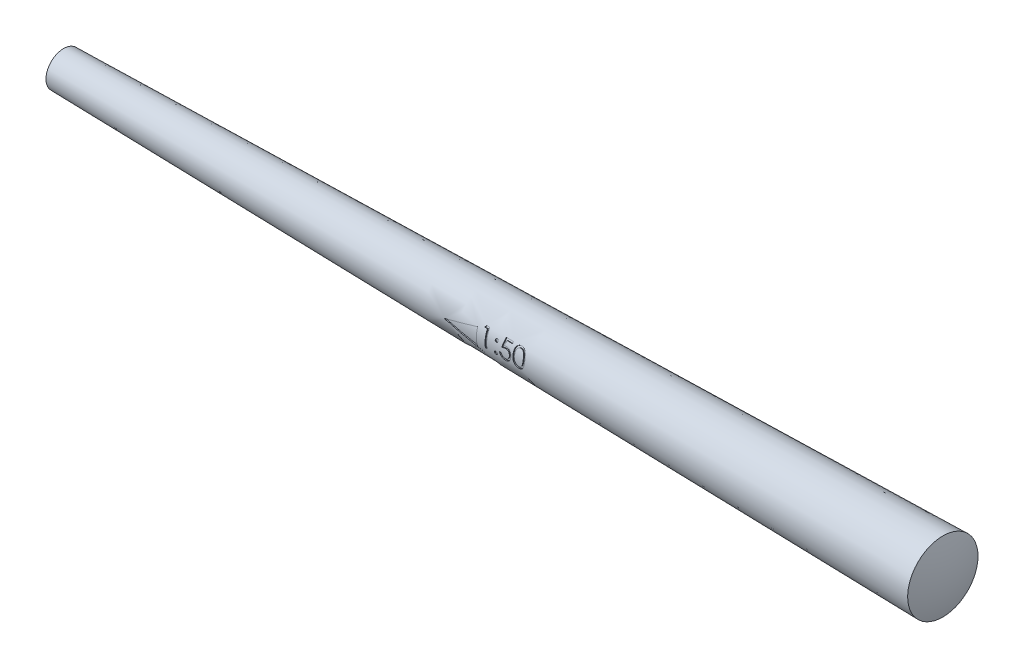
SolidWorks part; units mm, degrees
ref_plane "Front Plane" through (0, 0, 0) normal (0, 0, 1) x (1, 0, 0)
ref_plane "Top Plane" through (0, 0, 0) normal (0, 1, 0) x (1, 0, 0)
ref_plane "Right Plane" through (0, 0, 0) normal (1, 0, 0) x (0, 0, -1)
sketch "Sketch1" plane through (0, 0, 0) normal (1, 0, 0) x (0, 0, -1)
  circle A0 centre (0, 0) radius 1
  dimension "D1" = 2
extrude "Extrude1" add sketch "Sketch1" along normal mid plane 50
draft "Draft1" type of draft neutral plane draft angle 1.146 faces to draft 1 parameters "D1"=1.146
sketch "Sketch2" plane through (0, 0, 0) normal (0, 0, 1) x (1, 0, 0)
  line L0 (-25, 0) -> (-25, 1)
  line L1 (-25, 1) -> (-25, -1) construction
  line L2 (-25, 0) -> (-25.3, 0)
  line L3 (-25.3, 0) -> (-25.3, -1.5) construction
  line L4 (25, 0) -> (25, 2)
  line L5 (25, -2) -> (25, 2) construction
  line L6 (25, 0) -> (25.3, 0)
  line L7 (25.3, 0) -> (25.3, -1.5) construction
  line L8 (-25, -1) -> (25, -2) construction
  arc A0 (-25.3, 0) -> (-25, 1) centre (-23.4833, 0) cw
  arc A1 (25.3, 0) -> (25, 2) centre (18.4831, 0) ccw
  point P14 (0, -1.5)
revolve "Revolve1" add sketch "Sketch2" angle 360 about L2
sketch "Sketch5" plane through (0, 0, 0) normal (0, 0, 1) x (1, 0, 0)
  line L0 (0, 1.5) -> (0, -1.5) construction
  line L1 (25, 2) -> (-25, 1) construction
  line L2 (-25, -1) -> (25, -2) construction
ref_plane "Plane2" through (0, 0, 0) normal (-0.02, 0, 0.9998) x (0.9998, 0, 0.02)
sketch "Sketch6" plane through (0, 0, 0) normal (-0.02, 0, 0.9998) x (0.9998, 0, 0.02)
  line L0 (0, 0) -> (0, 0.5)
  line L1 (0, 1.5) -> (0, -1.5) construction
  line L2 (0, 0.5) -> (-1.866, 0)
  line L3 (-1.866, 0) -> (0, -0.5)
  line L4 (0, -0.5) -> (0, 0)
  line L5 (0, -0.25) -> (3, -0.25) construction
  text T0 "1:50" font "Century Gothic" height 1
  dimension "D1" = 1
  dimension "D2" = 30
  dimension "D3" = 3
wrap "Wrap2" sketch "Sketch6" wrap type deboss source sketch "Sketch6" thickness 0.05 parameters "D1"=0.05
equation "\"D2@Sketch2\" = \"D1@Sketch2\""
